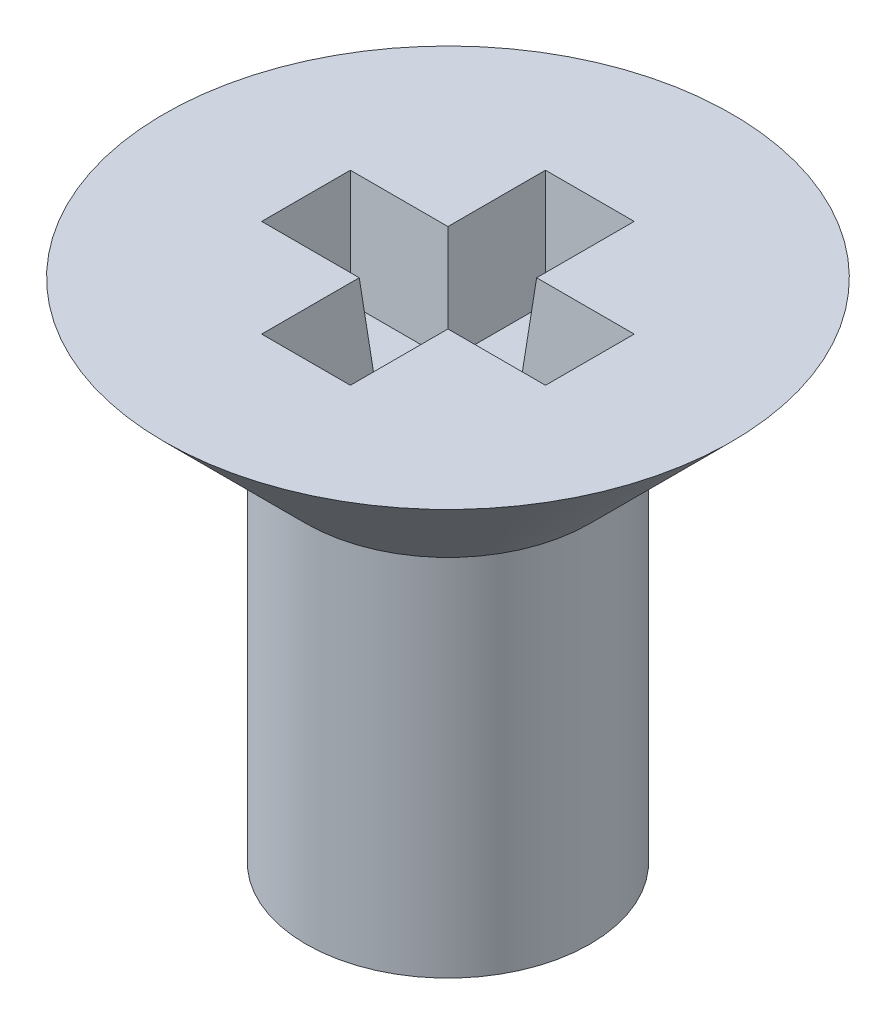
SolidWorks part; units mm, degrees
ref_plane "Front Plane" through (0, 0, 0) normal (0, 0, 1) x (1, 0, 0)
ref_plane "Top Plane" through (0, 0, 0) normal (0, 1, 0) x (1, 0, 0)
ref_plane "Right Plane" through (0, 0, 0) normal (1, 0, 0) x (0, 0, -1)
sketch "Sketch1" plane through (0, 0, 0) normal (0, 0, 1) x (1, 0, 0)
  line L0 (0, 0) -> (0, -38.263) construction
  line L1 (0, 0) -> (-2, 0)
  line L2 (-2, 0) -> (-2, 6)
  line L3 (-2, 6) -> (-4, 8)
  line L4 (-4, 8) -> (0, 8)
  line L5 (0, 8) -> (0, 0)
  dimension "D1" = 2
  dimension "D2" = 4
  dimension "D3" = 6
  dimension "D4" = 45
revolve "Revolve1" add sketch "Sketch1" angle 360 about L0
sketch "Sketch2" plane through (0, 8, 0) normal (0, 1, 0) x (1, 0, 0)
  line L0 (-0.625, 2) -> (-0.625, 0.625)
  line L1 (-2, -0.625) -> (2, -0.625) construction
  line L2 (-2, -0.625) -> (-2, 0.625)
  line L3 (-2, 0.625) -> (2, 0.625) construction
  line L4 (2, -0.625) -> (2, 0.625)
  line L5 (-2, -0.625) -> (2, 0.625) construction
  line L6 (-2, 0.625) -> (2, -0.625) construction
  line L7 (-0.625, -2) -> (0.625, -2)
  line L8 (-0.625, -2) -> (-0.625, 2) construction
  line L9 (-0.625, 2) -> (0.625, 2)
  line L10 (0.625, -2) -> (0.625, 2) construction
  line L11 (-0.625, -2) -> (0.625, 2) construction
  line L12 (-0.625, 2) -> (0.625, -2) construction
  line L13 (-0.625, 0.625) -> (-2, 0.625)
  line L14 (-2, -0.625) -> (-0.625, -0.625)
  line L15 (-0.625, -0.625) -> (-0.625, -2)
  line L16 (0.625, -2) -> (0.625, -0.625)
  line L17 (0.625, -0.625) -> (2, -0.625)
  line L18 (2, 0.625) -> (0.625, 0.625)
  line L19 (0.625, 0.625) -> (0.625, 2)
  point P0 (0, 0)
  point P6 (0, 0)
  dimension "D1" = 1.25
  dimension "D2" = 1.25
  dimension "D3" = 4
  dimension "D4" = 4
extrude "Cut-Extrude1" cut sketch "Sketch2" against normal blind 1.5 draft 5
chamfer "Chamfer1" distance 1.5 angle 30 1 edges at (0, 0, 2)
